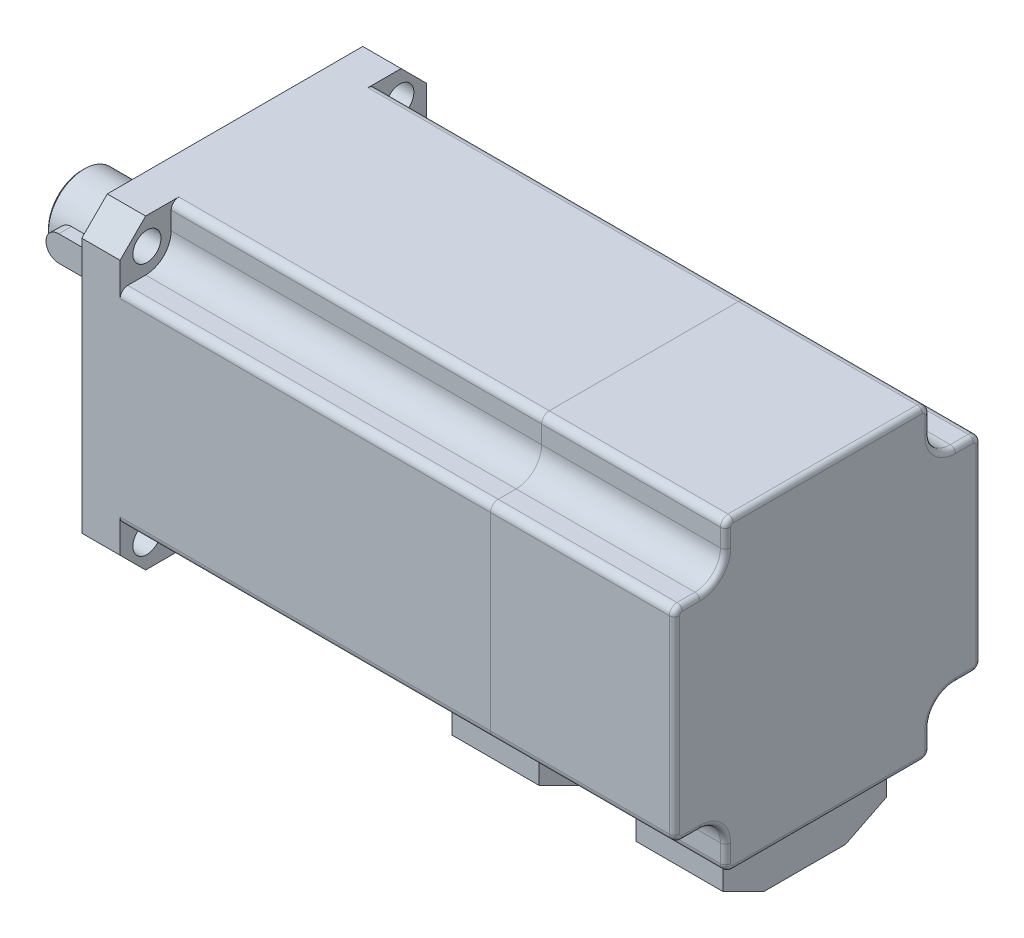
SolidWorks part; units mm, degrees
ref_plane "前视基准面" through (0, 0, 0) normal (0, 0, 1) x (1, 0, 0)
ref_plane "上视基准面" through (0, 0, 0) normal (0, 1, 0) x (1, 0, 0)
ref_plane "右视基准面" through (0, 0, 0) normal (1, 0, 0) x (0, 0, -1)
sketch "草图1" plane through (0, 0, 0) normal (1, 0, 0) x (0, 0, -1)
  line L0 (-30, 25) -> (-25, 30)
  line L1 (-25, -30) -> (25, -30)
  line L2 (-30, -25) -> (-30, 25)
  line L3 (-25, 30) -> (25, 30)
  line L4 (30, -25) -> (30, 25)
  line L5 (-30, -30) -> (30, 30) construction
  line L6 (-30, 30) -> (30, -30) construction
  line L7 (25, 30) -> (30, 25)
  line L8 (25, -30) -> (30, -25)
  line L9 (-30, -25) -> (-25, -30)
  point P0 (0, 0)
extrude "凸台-拉伸1" add sketch "草图1" along normal blind 80
sketch "草图2" plane through (80, 0, 0) normal (1, 0, 0) x (0, 0, -1)
  line L0 (25, 30) -> (-25, 30) construction
  line L1 (-25, -30) -> (25, -30)
  line L2 (-30, -25) -> (-30, 25)
  line L3 (-25, 30) -> (25, 30)
  line L4 (30, -25) -> (30, 25)
  line L5 (-30, -30) -> (30, 30) construction
  line L6 (-30, 30) -> (30, -30) construction
  line L7 (-30, 25) -> (-25, 30)
  line L8 (-30, -25) -> (-25, -30)
  line L9 (25, -30) -> (30, -25)
  line L10 (25, 30) -> (30, 25)
  point P0 (0, 0)
extrude "凸台-拉伸2" add sketch "草图2" along normal blind 36 separate body
sketch "草图3" plane through (116, 0, 0) normal (1, 0, 0) x (0, 0, -1)
  line L0 (-25, 20) -> (-28.5, 20)
  line L1 (-30, 18.5) -> (-30, 25)
  line L2 (-30, 25) -> (-25, 30)
  line L3 (-25, 30) -> (-18.5, 30)
  line L4 (18.5, 30) -> (25, 30)
  line L5 (25, 30) -> (30, 25)
  line L6 (30, 25) -> (30, 18.5)
  line L7 (-30, 25) -> (-30, -25) construction
  line L9 (-28.5, -20) -> (-25, -20)
  line L10 (30, -18.5) -> (30, -25)
  line L11 (-20, -25) -> (-20, -28.5)
  line L12 (-25, -30) -> (25, -30) construction
  line L14 (20, -28.5) -> (20, -25)
  line L15 (30, -25) -> (25, -30)
  line L16 (25, -20) -> (28.5, -20)
  line L17 (30, -25) -> (30, 25) construction
  line L19 (28.5, 20) -> (25, 20)
  line L20 (25, -30) -> (18.5, -30)
  line L21 (20, 25) -> (20, 28.5)
  line L23 (-18.5, -30) -> (-25, -30)
  line L24 (-20, 25) -> (-20, 28.5)
  line L25 (25, 30) -> (-25, 30) construction
  line L27 (-25, -30) -> (-30, -25)
  line L28 (-30, -25) -> (-30, -18.5)
  arc A0 (-25, 20) -> (-20, 25) centre (-25, 25) ccw
  arc A1 (20, 25) -> (25, 20) centre (25, 25) ccw
  arc A2 (25, -20) -> (20, -25) centre (25, -25) ccw
  arc A3 (-20, -25) -> (-25, -20) centre (-25, -25) ccw
  arc A4 (-30, -18.5) -> (-28.5, -20) centre (-28.5, -18.5) ccw
  arc A5 (-20, -28.5) -> (-18.5, -30) centre (-18.5, -28.5) ccw
  arc A6 (18.5, -30) -> (20, -28.5) centre (18.5, -28.5) ccw
  arc A7 (28.5, -20) -> (30, -18.5) centre (28.5, -18.5) ccw
  arc A8 (30, 18.5) -> (28.5, 20) centre (28.5, 18.5) ccw
  arc A9 (20, 28.5) -> (18.5, 30) centre (18.5, 28.5) ccw
  arc A10 (-20, 28.5) -> (-18.5, 30) centre (-18.5, 28.5) cw
  arc A11 (-28.5, 20) -> (-30, 18.5) centre (-28.5, 18.5) ccw
  point P0 (0, 0)
  point P10 (-30, -20)
  point P39 (-20, -30)
  point P42 (20, -30)
  point P45 (30, -20)
  point P48 (30, 20)
  point P53 (-20, 30)
  point P56 (-30, 20)
  dimension "D1" = 1.5
extrude "切除-拉伸1" cut sketch "草图3" against normal blind 108.5
fillet "圆角1" radius 1 24 edges at (116, 19.5607, 29.5607) (116, 20, 26.75) (116, 21.4645, 21.4645) (116, 26.75, 20) (116, 29.5607, 19.5607) (116, 30, 0) (116, 29.5607, -19.5607) (116, 26.75, -20) (116, 21.4645, -21.4645) (116, 20, -26.75) (116, 19.5607, -29.5607) (116, 0, -30) (116, -19.5607, -29.5607) (116, -20, -26.75) (116, -21.4645, -21.4645) (116, -26.75, -20) (116, -29.5607, -19.5607) (116, -30, 0) (116, -29.5607, 19.5607) (116, -26.75, 20) (116, -21.4645, 21.4645) (116, -20, 26.75) (116, -19.5607, 29.5607) (116, 0, 30)
sketch "草图4" plane through (0, 0, 0) normal (-1, 0, 0) x (0, 0, 1)
  circle A1 centre (-24.7487, 24.7487) radius 2.75
  circle A2 centre (24.7487, 24.7487) radius 2.75
  circle A3 centre (-24.7487, -24.7487) radius 2.75
  circle A4 centre (24.7487, -24.7487) radius 2.75
extrude "切除-拉伸2" cut sketch "草图4" against normal blind 7.5
sketch "草图5" plane through (0, 0, 0) normal (-1, 0, 0) x (0, 0, 1)
  circle A0 centre (0, 0) radius 25
  circle A1 centre (0, 0) radius 22.5
extrude "凸台-拉伸3" add sketch "草图5" along normal blind 3 separate body
sketch "草图6" plane through (0, 0, 0) normal (-1, 0, 0) x (0, 0, 1)
  circle A0 centre (0, 0) radius 7.5
extrude "凸台-拉伸4" add sketch "草图6" along normal blind 5
fillet "圆角2" radius 0.5 1 edges at (-5, 0, 7.5)
sketch "草图7" plane through (-5, 0, 0) normal (-1, 0, 0) x (0, 0, 1)
  circle A0 centre (0, 0) radius 7
  point P3 (0, 0)
extrude "凸台-拉伸5" add sketch "草图7" along normal blind 25
chamfer "倒角1" distance 0.5 angle 45 1 edges at (-30, 0, 7)
ref_plane "基准面1" through (0, 0, 7) normal (0, 0, 1) x (1, 0, 0)
sketch "草图8" plane through (0, 0, 7) normal (0, 0, 1) x (1, 0, 0)
  line L3 (-25.5, 2.5) -> (-10, 2.5)
  line L5 (-10, -2.5) -> (-25.5, -2.5)
  arc A0 (-25.5, 2.5) -> (-25.5, -2.5) centre (-25.5, 0) ccw
  arc A1 (-10, -2.5) -> (-10, 2.5) centre (-10, 0) ccw
extrude "切除-拉伸3" cut sketch "草图8" against normal blind 3
sketch "草图9" plane through (0, 0, 4) normal (0, 0, 1) x (1, 0, 0)
  line L0 (-25.5, 2.5) -> (-10, 2.5)
  line L2 (-10, -2.5) -> (-25.5, -2.5)
  arc A0 (-25.5, 2.5) -> (-25.5, -2.5) centre (-25.5, 0) ccw
  arc A1 (-10, -2.5) -> (-10, 2.5) centre (-10, 0) ccw
extrude "凸台-拉伸6" add sketch "草图9" along normal blind 5 separate body
sketch "草图10" plane through (0, -30, 0) normal (0, -1, 0) x (-1, 0, 0)
  line L3 (-94.5, 16) -> (-111.5, 16)
  line L4 (-94.5, 16) -> (-94.5, -16)
  line L5 (-94.5, -16) -> (-111.5, -16)
  line L6 (-111.5, 16) -> (-111.5, -16)
  line L7 (-94.5, 16) -> (-111.5, -16) construction
  line L8 (-94.5, -16) -> (-111.5, 16) construction
  line L11 (-58.5, 16) -> (-75.5, 16)
  line L12 (-58.5, 16) -> (-58.5, -16)
  line L13 (-58.5, -16) -> (-75.5, -16)
  line L14 (-75.5, 16) -> (-75.5, -16)
  line L15 (-58.5, 16) -> (-75.5, -16) construction
  line L16 (-58.5, -16) -> (-75.5, 16) construction
extrude "凸台-拉伸7" add sketch "草图10" along normal blind 11 separate body
sketch "草图11" plane through (58.5, 0, 0) normal (-1, 0, 0) x (0, 0, 1)
  line L0 (-16, -41) -> (-16, -37)
  line L1 (-16, -41) -> (-16, -30) construction
  line L2 (-16, -41) -> (-8, -41)
  line L3 (16, -41) -> (-16, -41) construction
  line L4 (16, -41) -> (16, -37)
  line L5 (16, -41) -> (8, -41)
  line L6 (-16, -37) -> (-8, -41)
  line L7 (8, -41) -> (16, -37)
extrude "切除-拉伸4" cut sketch "草图11" against normal blind 53
